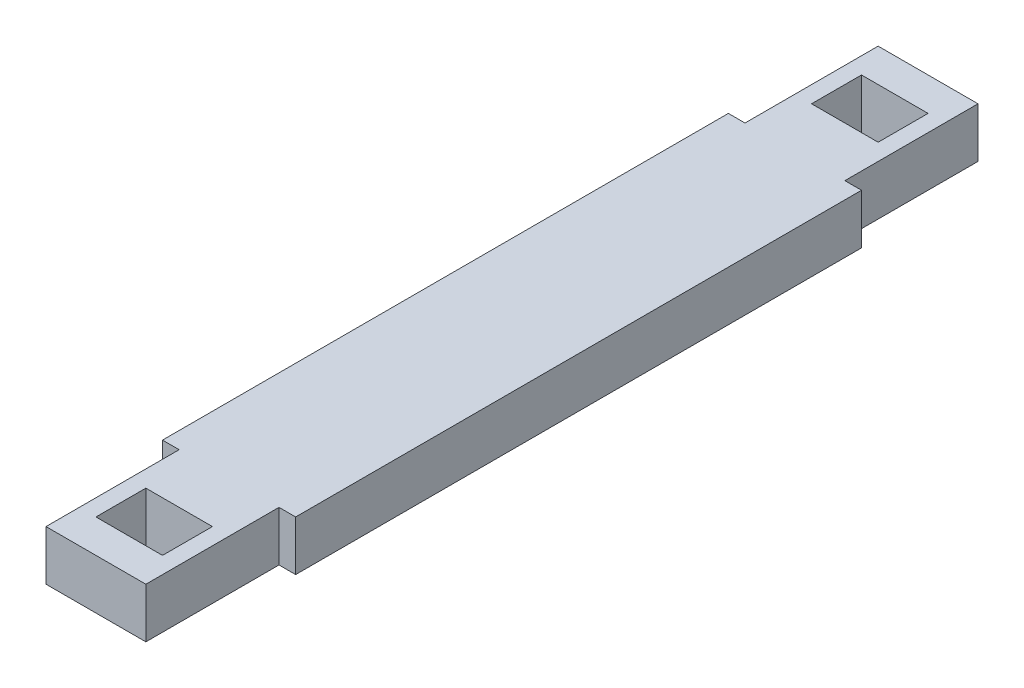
SolidWorks part; units mm, degrees
ref_plane "Front Plane" through (0, 0, 0) normal (0, 0, 1) x (1, 0, 0)
ref_plane "Top Plane" through (0, 0, 0) normal (0, 1, 0) x (1, 0, 0)
ref_plane "Right Plane" through (0, 0, 0) normal (1, 0, 0) x (0, 0, -1)
sketch "Sketch1" plane through (0, 0, 0) normal (0, 0, 1) x (1, 0, 0)
  line L1 (-15, -7.5) -> (15, -7.5)
  line L2 (-15, -7.5) -> (-15, 7.5)
  line L3 (-15, 7.5) -> (15, 7.5)
  line L4 (15, -7.5) -> (15, 7.5)
  line L5 (-15, -7.5) -> (15, 7.5) construction
  line L6 (-15, 7.5) -> (15, -7.5) construction
  point P0 (0, 0)
  dimension "D1" = 30
  dimension "D2" = 15
extrude "Boss-Extrude1" add sketch "Sketch1" along normal blind 250
sketch "Sketch2" plane through (0, 7.5, 0) normal (0, 1, 0) x (1, 0, 0)
  line L0 (-15, -250) -> (-15, 0) construction
  line L1 (-10, -10) -> (10, -10)
  line L2 (-10, -10) -> (-10, -25)
  line L3 (-10, -25) -> (10, -25)
  line L4 (10, -10) -> (10, -25)
  line L5 (15, 0) -> (-15, 0) construction
  line L6 (-103.7245, -125) -> (115.7154, -125) construction
  line L7 (15, -250) -> (-15, -250) construction
  line L8 (10, -240) -> (10, -225)
  line L9 (-10, -225) -> (10, -225)
  line L10 (-10, -240) -> (-10, -225)
  line L11 (-10, -240) -> (10, -240)
  dimension "D1" = 15
  dimension "D2" = 20
  dimension "D3" = 5
  dimension "D4" = 10
extrude "Cut-Extrude1" cut sketch "Sketch2" against normal blind 15
sketch "Sketch4" plane through (0, 7.5, 0) normal (0, 1, 0) x (1, 0, 0)
  line L0 (-15, -250) -> (-15, 0) construction
  line L1 (-20, -40) -> (20, -40)
  line L2 (-20, -40) -> (-20, -210)
  line L3 (-20, -210) -> (20, -210)
  line L4 (20, -40) -> (20, -210)
  line L5 (15, -250) -> (15, 0) construction
  line L6 (-10, -25) -> (10, -25) construction
  line L7 (10, -225) -> (-10, -225) construction
  dimension "D1" = 5
  dimension "D2" = 5
  dimension "D3" = 15
  dimension "D4" = 15
extrude "Boss-Extrude3" add sketch "Sketch4" against normal blind 15
